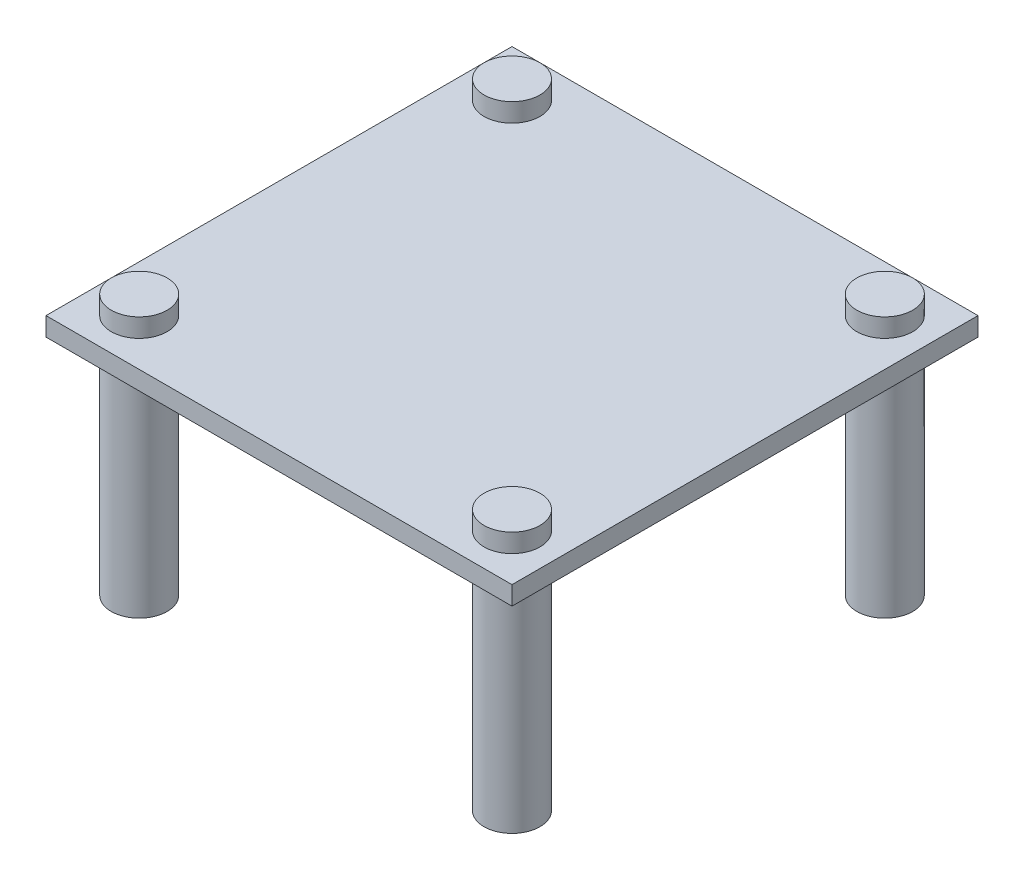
SolidWorks part; units mm, degrees
other "Objet de détail5"
other "Objet de détail6"
other "Objet de détail2"
other "Objet de détail4"
ref_plane "Plan de face" through (0, 0, 0) normal (0, 0, 1) x (1, 0, 0)
ref_plane "Plan de dessus" through (0, 0, 0) normal (0, 1, 0) x (1, 0, 0)
ref_plane "Plan de droite" through (0, 0, 0) normal (1, 0, 0) x (0, 0, -1)
sketch "Esquisse1" plane through (0, 0, 0) normal (0, 1, 0) x (1, 0, 0)
  line L1 (0, 0) -> (250, 0)
  line L2 (0, 0) -> (0, 250)
  line L3 (0, 250) -> (250, 250)
  line L4 (250, 0) -> (250, 250)
  dimension "D1" = 250
  dimension "D2" = 250
extrude "Boss.-Extru.1" add sketch "Esquisse1" along normal blind 10
sketch "Esquisse2" plane through (0, 0, 0) normal (0, -1, 0) x (-1, 0, 0)
  line L1 (-250, 250) -> (0, 250) construction
  circle A0 centre (-25, 225) radius 15
  circle A1 centre (-225, 225) radius 15
  circle A2 centre (-25, 25) radius 15
  circle A3 centre (-225, 25) radius 15
  dimension "D2" = 30
  dimension "D1" = 25
  dimension "D3" = 25
  dimension "D4" = 25
  dimension "D5" = 25
extrude "Boss.-Extru.2" add sketch "Esquisse2" along normal blind 120
sketch "Esquisse3" plane through (0, 0, 0) normal (0, -1, 0) x (-1, 0, 0)
  circle A0 centre (-25, 225) radius 15
  circle A1 centre (-225, 225) radius 15
  circle A2 centre (-25, 25) radius 15
  circle A3 centre (-225, 25) radius 15
extrude "Boss.-Extru.3" add sketch "Esquisse3" against normal blind 20
sketch "Esquisse5" plane through (0, 0, 0) normal (0, -1, 0) x (-1, 0, 0)
  text T0 "TABLE" font "Century Gothic" height in points 70
